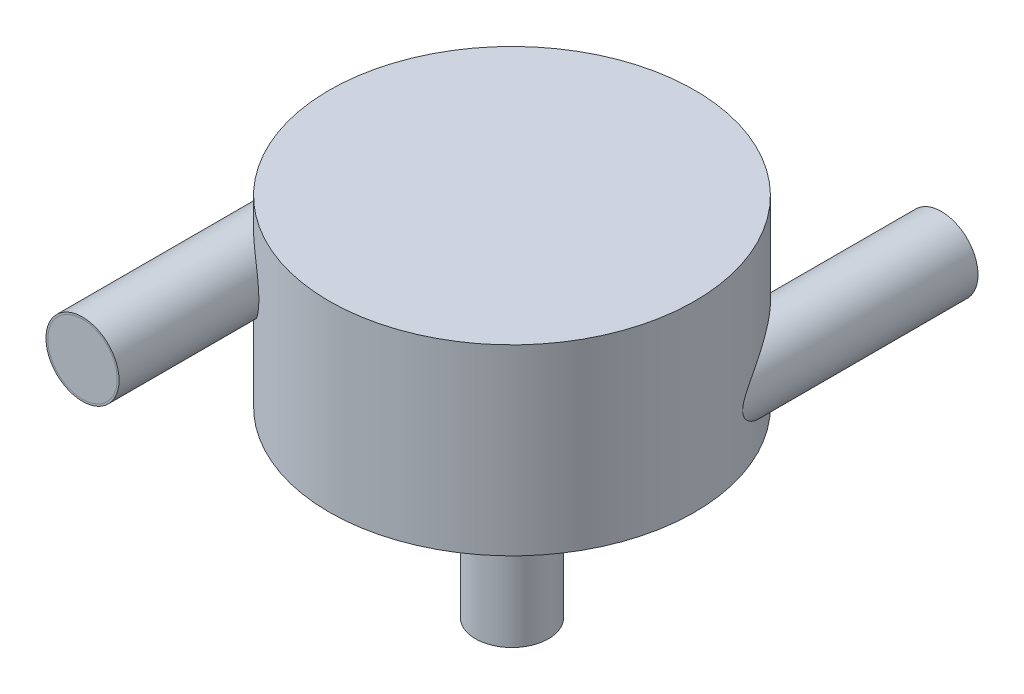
SolidWorks part; units mm, degrees
ref_plane "Front Plane" through (0, 0, 0) normal (0, 0, 1) x (1, 0, 0)
ref_plane "Top Plane" through (0, 0, 0) normal (0, 1, 0) x (1, 0, 0)
ref_plane "Right Plane" through (0, 0, 0) normal (1, 0, 0) x (0, 0, -1)
sketch "Sketch1" plane through (0, 0, 0) normal (0, 1, 0) x (1, 0, 0)
  circle A0 centre (0, 0) radius 1000
  dimension "D1" = 2000
extrude "Boss-Extrude1" add sketch "Sketch1" along normal blind 1000
ref_plane "Plane1" through (0, 0, 1600) normal (0, 0, 1) x (1, 0, 0)
sketch "Sketch2" plane through (0, 0, 1600) normal (0, 0, 1) x (1, 0, 0)
  circle A0 centre (-750, 650) radius 200
  dimension "D1" = 400
  dimension "D2" = 750
  dimension "D3" = 650
extrude "Boss-Extrude2" add sketch "Sketch2" against normal up to surface contours A0
ref_plane "Plane2" through (0, 0, -1600) normal (0, 0, 1) x (1, 0, 0)
sketch "Sketch3" plane through (0, 0, -1600) normal (0, 0, 1) x (1, 0, 0)
  circle A0 centre (750, 300) radius 200
  dimension "D1" = 400
  dimension "D2" = 750
  dimension "D3" = 300
extrude "Boss-Extrude3" add sketch "Sketch3" along normal up to surface
sketch "Sketch5" plane through (0, 0, 0) normal (0, -1, 0) x (1, 0, 0)
  circle A0 centre (0, 0) radius 200
  dimension "D1" = 400
extrude "Boss-Extrude4" add sketch "Sketch5" along normal blind 1000 contours A0
shell "Shell1" thickness 10
sketch "Sketch6" plane through (0, 0, 1600) normal (0, 0, 1) x (1, 0, 0)
  circle A0 centre (-750, 650) radius 190
  dimension "D1" = 380
extrude "Lid 1" add sketch "Sketch6" against normal blind 50 separate body
sketch "Sketch7" plane through (0, 0, -1600) normal (0, 0, -1) x (-1, 0, 0)
  circle A0 centre (-750, 300) radius 190
  dimension "D1" = 380
extrude "Lid 2" add sketch "Sketch7" against normal blind 50 separate body
sketch "Sketch8" plane through (0, -1000, 0) normal (0, -1, 0) x (1, 0, 0)
  circle A0 centre (0, 0) radius 190
  dimension "D1" = 380
extrude "Lid 3" add sketch "Sketch8" against normal blind 50 separate body
